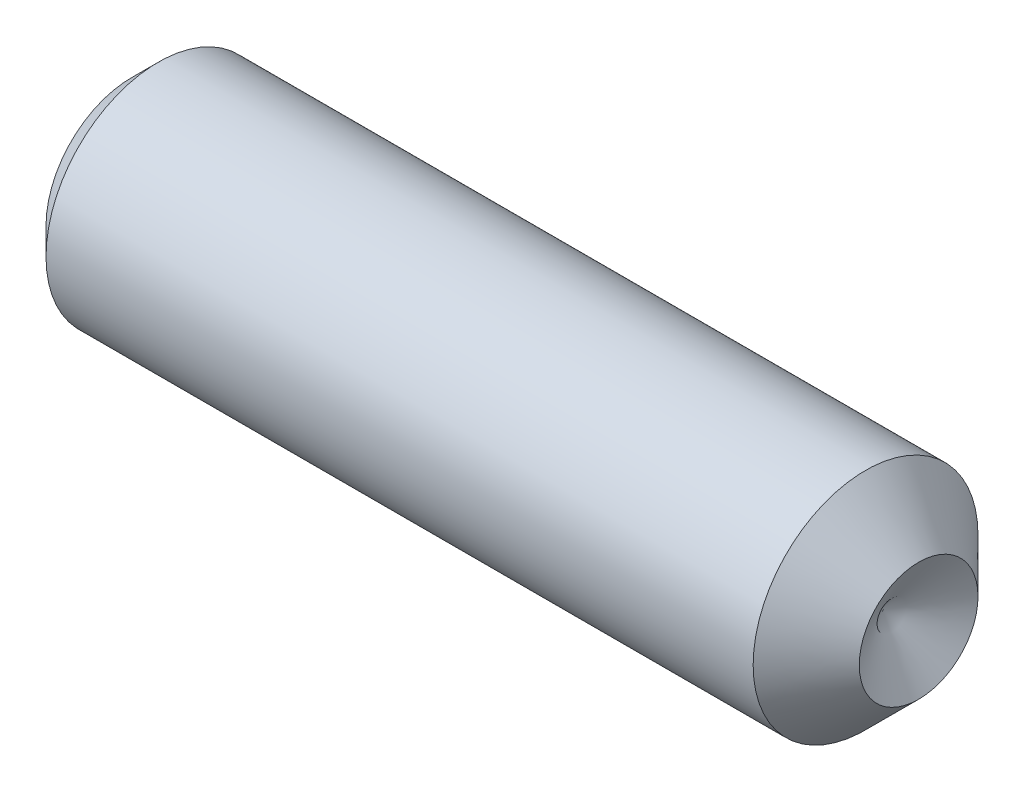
SolidWorks part; units mm, degrees
revolve "BaseBody" add sketch "BodySke" angle 360 about L5
sketch "BodySke" plane through (0, 0, 0) normal (0, 0, 1) x (1, 0, 0)
  line L0 (0, 0) -> (0, 2.4194)
  line L1 (0, 2.4194) -> (0.7557, 3.175)
  line L2 (0.7557, 3.175) -> (20.7264, 3.175)
  line L3 (20.7264, 3.175) -> (22.225, 1.6764)
  line L4 (21.2177, 0) -> (0, 0)
  line L5 (-12.7, 0) -> (88.9, 0) construction
  line L6 (21.2177, 0) -> (22.225, 1.6764)
  line L7 (22.225, 1.6764) -> (22.225, 11.2014) construction
  line L8 (0, -2.4193) -> (0.7557, -3.175) construction
  line L9 (21.2177, 0) -> (22.225, -1.6764) construction
  line L10 (20.7264, -3.175) -> (22.225, -1.6764) construction
  line L11 (1.27, 15.875) -> (1.27, -3.175) construction
ref_plane "Plane1" through (0, 0, 0) normal (0, 0, 1) x (1, 0, 0)
ref_plane "Plane2" through (0, 0, 0) normal (0, 1, 0) x (1, 0, 0)
ref_plane "Plane3" through (0, 0, 0) normal (1, 0, 0) x (0, 0, -1)
other "Configuration Table"
sketch "Sketch2" plane through (0, 0, 0) normal (-1, 0, 0) x (0, 0, 1)
  line L0 (0.9165, 1.5875) -> (-0.9165, 1.5875)
  line L1 (-0.9165, 1.5875) -> (-1.8331, 0)
  line L2 (0.9165, 1.5875) -> (1.8331, 0)
  line L3 (0.9165, -1.5875) -> (1.8331, 0)
  line L4 (0.9165, -1.5875) -> (-0.9165, -1.5875)
  line L5 (-0.9165, -1.5875) -> (-1.8331, 0)
extrude "Hex" cut sketch "Sketch2" against normal blind 3.175
sketch "Sketch4" plane through (0, 4.7709, -0.5249) normal (-1, 0, 0) x (0, 0, 1)
  line L0 (0.5249, -4.7709) -> (2.4172, -4.7709)
  line L1 (0.5249, -4.7709) -> (6.6732, -1.2211) construction
  line L2 (0.5249, -4.7709) -> (1.471, -3.1321)
  line L3 (2.0912, -4.3358) -> (2.3286, -4.1988)
  line L4 (1.6848, -3.6319) -> (1.9222, -3.4948)
  arc A0 (2.0912, -4.3358) -> (1.6848, -3.6319) centre (0.5249, -4.7709) ccw
  arc A1 (2.4172, -4.7709) -> (2.3286, -4.1988) centre (0.5249, -4.7709) ccw
  arc A2 (1.471, -3.1321) -> (1.9222, -3.4948) centre (0.5249, -4.7709) cw
  circle A3 centre (0.5249, -4.7709) radius 1.6256 construction
  circle A4 centre (0.5249, -4.7709) radius 1.8923 construction
extrude "Spline" [suppressed] cut sketch "Sketch4" against normal blind 3.175
pattern_circular "CirPattern1" [suppressed] count 6 every 60 about axis through (-12.7, 0, 0) along (1, 0, 0)
sketch "ThdSchSke" plane through (0, 0, 0) normal (0, 0, 1) x (1, 0, 0)
  line L0 (0.7557, -2.4193) -> (0.2265, -3.175)
  line L1 (0.7557, -2.4193) -> (1.2848, -3.175)
  line L2 (1.2848, -3.175) -> (1.2848, -3.9688)
  line L3 (-3.175, 0) -> (5.1513, 0) construction
  line L4 (0.7557, 3.175) -> (0.7557, -3.175) construction
  line L5 (1.2848, -3.9688) -> (0.2265, -3.9688)
  line L6 (0.2265, -3.9688) -> (0.2265, -3.175)
revolve "ThreadSchematic" [suppressed] cut sketch "ThdSchSke" angle 360 about L3
pattern_linear "ThdSchPat" [suppressed]
equation "\"D2@Sketch2\" = \"Hex_size@Sketch2\" / 2"
equation "\"D3@Sketch2\" = \"Hex_size@Sketch2\" / 2"
equation "\"Thread_minor@ThreadCosmetic\" = \"Minor_dia@BodySke\""
equation "\"D1@Sketch4\" = \"Spline_a_dim@Sketch4\" / 2"
equation "\"D3@Sketch4\" = \"Spline_p_dim@Sketch4\" / 2"
equation "\"D2@CirPattern1\" = \"Spline_a_dim@Sketch4\""
equation "\"Num_teeth@CirPattern1\" = 360 / \"D2@CirPattern1\""
equation "\"Thread_minor@ThdSchSke\" = \"Thread_minor@ThreadCosmetic\""
equation "\"Diameter@ThdSchSke\" = \"Diameter@BodySke\""
equation "\"Overcut@ThdSchSke\" = \"Diameter@BodySke\" * 1.25"
equation "\"Num_threads@ThdSchPat\" = int( (\"Length@BodySke\" - ( ( ( \"Diameter@BodySke\" - \"Minor_dia@BodySke\" ) * 0.5 ) / tan( \"Drive_ch_ang@BodySke\" ) ) - ( ( ( \"Diameter@BodySke\" - \"Cup_dia@BodySke\" ) * 0.5 ) *"
equation "\"Advance@ThdSchPat\" = (\"Length@BodySke\" - ( ( ( \"Diameter@BodySke\" - \"Minor_dia@BodySke\" ) * 0.5 ) / tan( \"Drive_ch_ang@BodySke\" ) ) - ( ( ( \"Diameter@BodySke\" - \"Cup_dia@BodySke\" ) * 0.5 ) * tan( \"Cu"
equation "' \"Num_threads@ThdSchPat\" = \"Num_threads@ThdSchPat\" - sgn( \"Num_threads@ThdSchPat\" - 1) '---chamfered tips only---"
